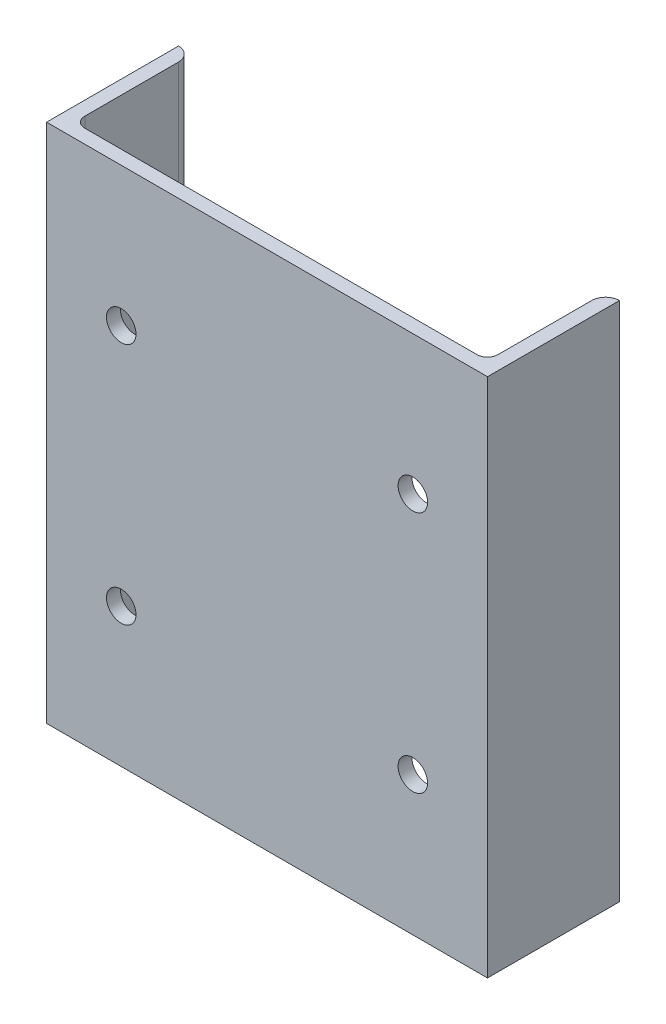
SolidWorks part; units mm, degrees
ref_plane "Front Plane" through (0, 0, 0) normal (0, 0, 1) x (1, 0, 0)
ref_plane "Top Plane" through (0, 0, 0) normal (0, 1, 0) x (1, 0, 0)
ref_plane "Right Plane" through (0, 0, 0) normal (1, 0, 0) x (0, 0, -1)
sketch "Sketch1" plane through (0, 0, 0) normal (0, 1, 0) x (1, 0, 0)
  line L0 (-127, 0) -> (127, 0)
  line L1 (-127, 0) -> (-127, 76)
  line L2 (127, 0) -> (127, 76)
  line L3 (-113, 8) -> (113, 8)
  line L4 (119, 14) -> (119, 68)
  line L5 (-119, 14) -> (-119, 68)
  arc A0 (113, 8) -> (119, 14) centre (113, 14) ccw
  arc A1 (-113, 8) -> (-119, 14) centre (-113, 14) cw
  arc A2 (119, 68) -> (127, 76) centre (127, 68) cw
  arc A3 (-119, 68) -> (-127, 76) centre (-127, 68) ccw
  point P11 (119, 8)
  point P14 (-119, 8)
  dimension "D6" = 6
  dimension "D7" = 6
  dimension "D1" = 254
  dimension "D2" = 238
  dimension "D3" = 60
  dimension "D4" = 76
  dimension "D5" = 8
  dimension "D8" = 127
  dimension "D9" = 119
extrude "Extrude1" add sketch "Sketch1" along normal mid plane 300
sketch "Sketch2" plane through (0, 0, 0) normal (0, 0, 1) x (1, 0, 0)
  line L0 (127, 150) -> (127, -150) construction
  circle A0 centre (84, 70) radius 8.5
  circle A1 centre (-84, 70) radius 8.5
  circle A2 centre (-84, -70) radius 8.5
  circle A3 centre (84, -70) radius 8.5
  dimension "D1" = 17
  dimension "D2" = 70
  dimension "D3" = 70
  dimension "D4" = 168
  dimension "D7" = 43
extrude "Cut-Extrude1" cut sketch "Sketch2" against normal up to next
